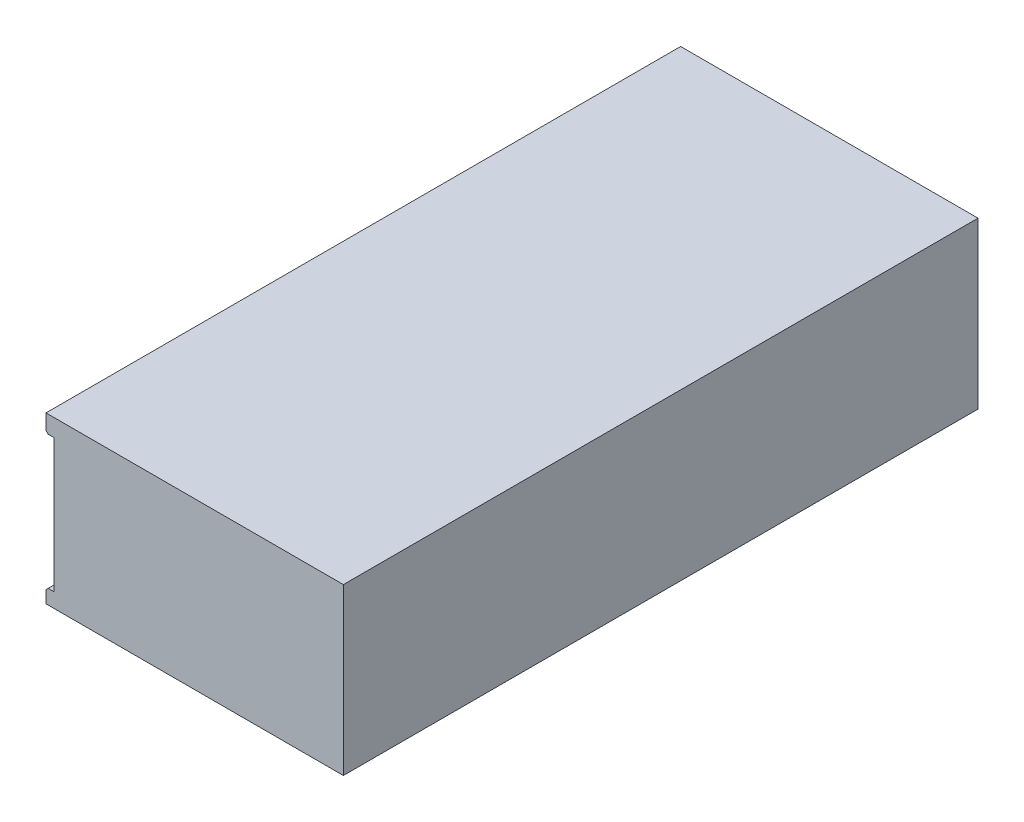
SolidWorks part; units mm, degrees
ref_plane "FRONT" through (0, 0, 0) normal (0, 0, 1) x (1, 0, 0)
ref_plane "TOP" through (0, 0, 0) normal (0, 1, 0) x (1, 0, 0)
ref_plane "RIGHT" through (0, 0, 0) normal (1, 0, 0) x (0, 0, -1)
sketch "Sketch1" plane through (0, 0, 0) normal (0, 0, 1) x (1, 0, 0)
  line L0 (50.673, 0) -> (50.673, -28.956)
  line L1 (50.673, -28.956) -> (-1.397, -28.956)
  line L2 (-1.397, -28.956) -> (-1.397, -26.416)
  line L3 (-1.397, -26.416) -> (0, -26.416)
  line L4 (0, -26.416) -> (0, -3.048)
  line L5 (0, -3.048) -> (-1.397, -3.048)
  line L6 (-1.397, -3.048) -> (-1.397, 0)
  line L7 (-1.397, 0) -> (50.673, 0)
  dimension "D1" = 52.07
  dimension "D2" = 50.673
  dimension "D3" = 3.048
  dimension "D4" = 2.54
  dimension "D5" = 28.956
extrude "Extrude1" add sketch "Sketch1" along normal mid plane 111.125
sketch "Sketch2" plane through (0, 0, 0) normal (-1, 0, 0) x (0, 0, 1)
  line L0 (0, 0) -> (0, -28.956) construction
  line L1 (55.5625, -28.956) -> (-55.5625, -28.956) construction
  line L2 (0, -14.478) -> (49.1702, -14.478) construction
  point P0 (-50.2666, -6.35)
  point P1 (50.2666, -6.35)
  point P2 (4.8768, -6.35)
  point P4 (-4.8768, -6.35)
  point P5 (-50.2666, -23.114)
  point P7 (-4.8768, -23.114)
  point P8 (4.8768, -23.114)
  point P14 (50.2666, -23.114)
  dimension "D1" = 50.2666
  dimension "D2" = 50.2666
  dimension "D3" = 4.8768
  dimension "D4" = 8.128
  dimension "D5" = 8.636
hole_wizard "#10-32 Tapped Hole1" positions "3DSketch1" profile "Sketch3" tap size "#10-32" standard "Ansi Inch"
sketch3d "3DSketch1"
  point P0 (0, -6.35, -50.2666)
  point P3 (0, -6.35, 50.2666)
  point P6 (0, -6.35, 4.8768)
  point P9 (0, -6.35, -4.8768)
  point P12 (0, -23.114, -50.2666)
  point P15 (0, -23.114, -4.8768)
  point P18 (0, -23.114, 4.8768)
  point P21 (0, -23.114, 50.2666)
sketch "Sketch3" plane through (0, -6.35, -50.2666) normal (0, 1, 0) x (0, 0, 1)
  line L0 (0, 0) -> (0, 11.2108)
  line L1 (0, 11.2108) -> (2.0193, 9.9974)
  line L2 (2.0193, 9.9974) -> (2.0193, 7.62)
  line L3 (2.0193, 7.62) -> (2.413, 7.62)
  line L4 (2.413, 7.62) -> (2.413, 0)
  line L5 (2.413, 0) -> (0, 0)
  line L10 (0, 11.2108) -> (-2.0193, 9.9974) construction
  line L11 (0, -6.35) -> (0, 107.95) construction
  dimension "Tap Drill Dia." = 4.0386
  dimension "Tap Drill Depth" = 9.9974
  dimension "Thread Major Dia." = 4.826
  dimension "Thread Depth" = 7.62
  dimension "Drill Angle" = 118
chamfer "Chamfer1" distance 0.381 angle 45 2 edges at (-1.397, -26.416, 0) (-1.397, -3.048, 0)
